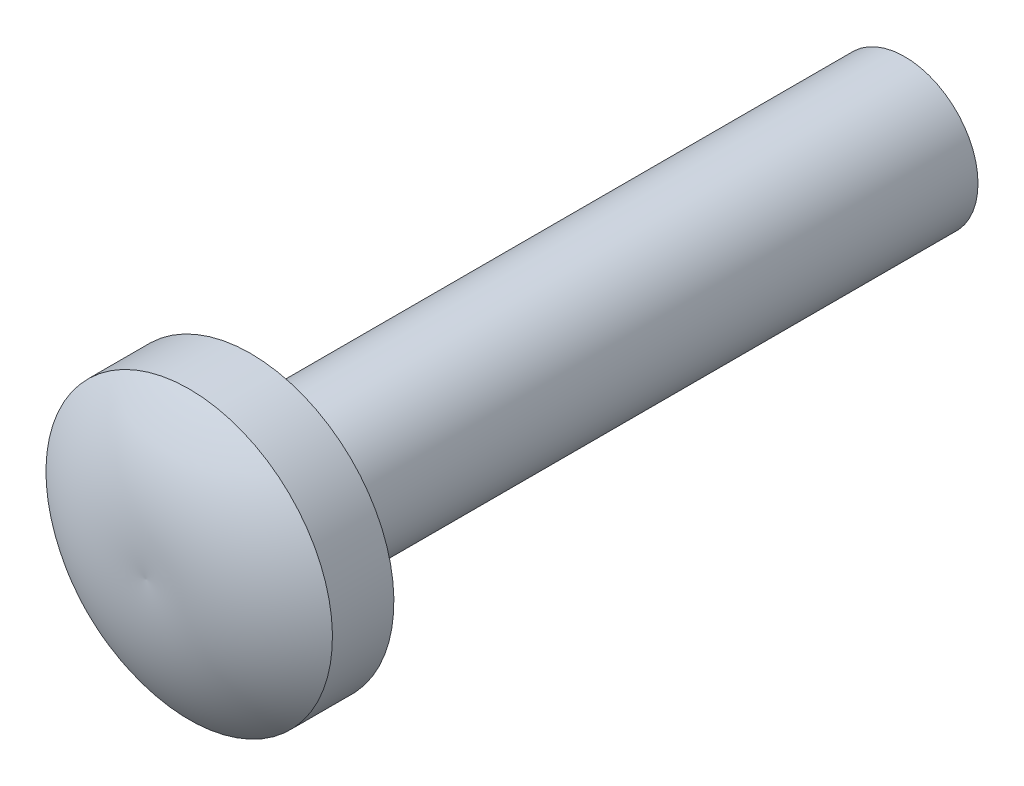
SolidWorks part; units mm, degrees
ref_plane "Front Plane" through (0, 0, 0) normal (0, 0, 1) x (1, 0, 0)
ref_plane "Top Plane" through (0, 0, 0) normal (0, 1, 0) x (1, 0, 0)
ref_plane "Right Plane" through (0, 0, 0) normal (1, 0, 0) x (0, 0, -1)
sketch "Sketch1" plane through (0, 0, 0) normal (0, 0, 1) x (1, 0, 0)
  circle A0 centre (0, 0) radius 1.4224
  dimension "D1" = 2.8448
extrude "Boss-Extrude1" add sketch "Sketch1" along normal blind 12.7
sketch "Sketch3" plane through (0, 0, 0) normal (1, 0, 0) x (0, 0, -1)
  line L0 (-12.7, 0) -> (-14.732, 0)
  line L1 (-12.7, 1.4224) -> (-12.7, -1.4224) construction
  line L2 (-12.7, 0) -> (-12.7, 2.7813)
  line L3 (-12.7, 2.7813) -> (-13.8931, 2.7813)
  spline S0 degree 2 poles (-13.8931, 2.7813) (-14.8701, 1.5267) (-14.732, 0) knots 0 0 0 1 1 1
  dimension "D1" = 2.032
  dimension "D2" = 2.7813
revolve "Revolve1" add sketch "Sketch3" angle 360 about L0
